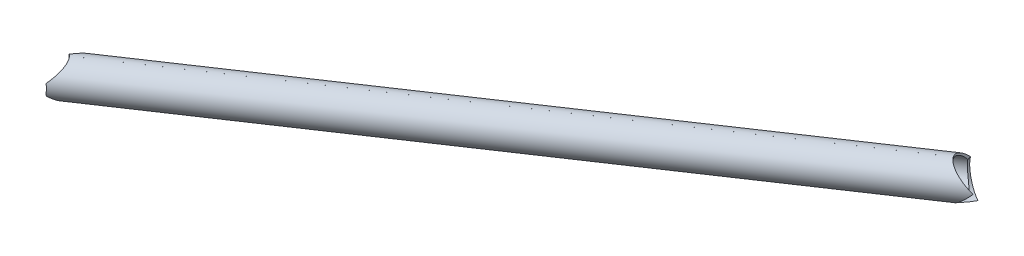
SolidWorks part; units mm, degrees
ref_plane "Ebene vorne" through (0, 0, 0) normal (0, 0, 1) x (1, 0, 0)
ref_plane "Ebene oben" through (0, 0, 0) normal (0, 1, 0) x (1, 0, 0)
ref_plane "Ebene rechts" through (0, 0, 0) normal (1, 0, 0) x (0, 0, -1)
imported_body "Basisteil-Rahmen_neu4-1-1"
ref_plane "Ebene1" through (187.5939, 3.2582, -742.7335) normal (0.8305, 0, -0.557) x (-0.557, 0, -0.8305)
sketch "Skizze1" plane through (187.5939, 3.2582, -742.7335) normal (0.8305, 0, -0.557) x (-0.557, 0, -0.8305)
  line L0 (13.0494, -3.2582) -> (13.0494, 14.2494) construction
  line L2 (13.0494, -10.9463) -> (13.0494, 12.1181) construction
  line L3 (16.1794, -3.2582) -> (0.9436, -3.2582) construction
  line L5 (13.0444, 17.2506) -> (13.0544, 17.2506)
  line L6 (13.0444, 17.2506) -> (13.0444, 0.7731)
  line L7 (13.0444, 0.7731) -> (13.0544, 0.7731)
  line L8 (13.0544, 17.2506) -> (13.0544, 0.7731)
  dimension "D1" = 0.01
extrude "Schnitt-Linear austragen2" cut sketch "Skizze1" against normal through all and the other way through all
sheet metal parameters "Blech5" parameters "D1"=0, "Dicke"=1.4
bend "Biegung-Rundung5" bend radius 12.05 bend angle 359.957 parameters "D5"=1
flatten bends "Abwickeln5"
sketch "Skizze-Winkel5" plane through (388.7929, 13.45, -893.361) normal (0.0002, 1, 0.0003) x (-1, 0.0002, 0)
  line L0 (-223.57, -99.0538) -> (176.5089, 169.2344) construction
  dimension "D1" = 0
process bends "Abbiegen5"
sketch "Abwicklung-Skizze5" plane through (0, 0, 0) normal (0.0002, 1, 0.0003) x (-1, 0.0002, 0)
  dimension "D1" = 0
flat pattern "Abwicklung5"
sketch "Biegung-Linien5" plane through (0, 0, 0) normal (0, 1, 0) x (-1, 0, 0)
bend of the flat pattern "Abwickeln-<Biegung-Rundung5>1"
